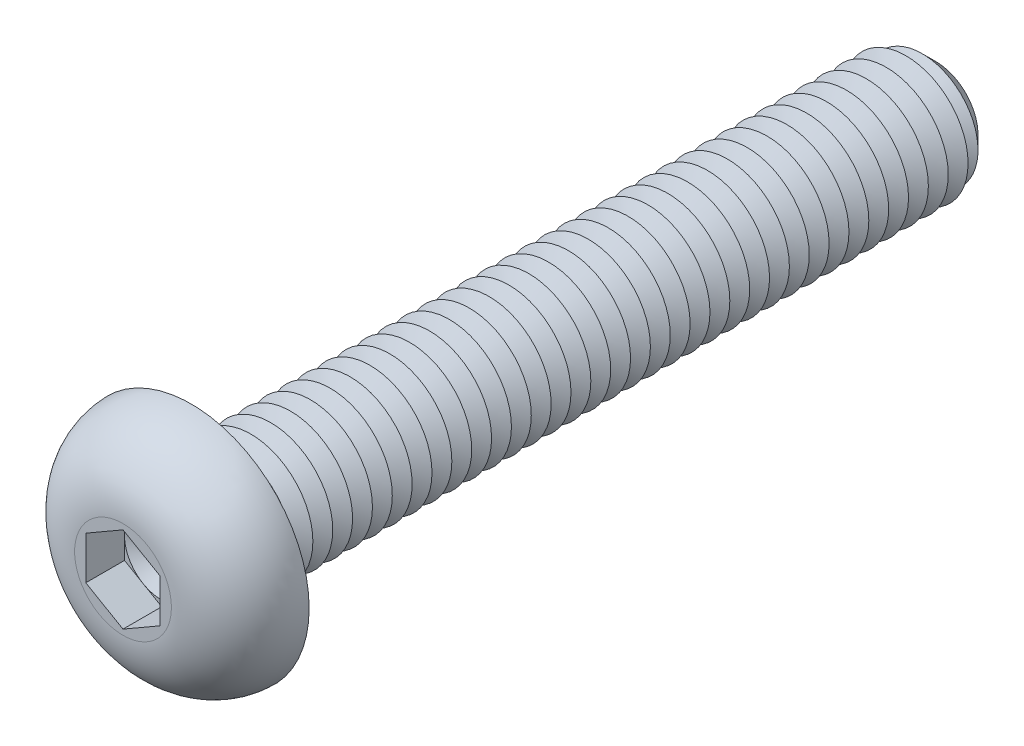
SolidWorks part; units mm, degrees
ref_plane "Front Plane" through (0, 0, 0) normal (0, 0, 1) x (1, 0, 0)
ref_plane "Top Plane" through (0, 0, 0) normal (0, 1, 0) x (1, 0, 0)
ref_plane "Right Plane" through (0, 0, 0) normal (1, 0, 0) x (0, 0, -1)
sketch "Sketch1" plane through (0, 0, 0) normal (1, 0, 0) x (0, 0, -1)
  line L0 (-47.9342, 0) -> (60.3146, 0) construction
sketch "Sketch2" plane through (0, 0, 0) normal (1, 0, 0) x (0, 0, -1)
  line L0 (0, 0) -> (-2.75, 0)
  line L1 (-47.9342, 0) -> (60.3146, 0) construction
  line L2 (-2.75, 0) -> (-2.75, 1.9504)
  line L3 (0, 4.75) -> (0, 0)
  arc A0 (-2.75, 1.9504) -> (0, 4.75) centre (0.05, 1.9504) cw
  dimension "D1" = 2.8
  dimension "D2" = 2.75
  dimension "D3" = 4.75
revolve "Revolve1" add sketch "Sketch2" angle 360 about L0
sketch "Sketch3" plane through (0, 0, 2.75) normal (0, 0, 1) x (1, 0, 0)
  line L1 (0, 1.7321) -> (-1.5, 0.866)
  line L2 (-1.5, 0.866) -> (-1.5, -0.866)
  line L3 (-1.5, -0.866) -> (0, -1.7321)
  line L4 (0, -1.7321) -> (1.5, -0.866)
  line L5 (1.5, -0.866) -> (1.5, 0.866)
  line L6 (1.5, 0.866) -> (0, 1.7321)
  circle A0 centre (0, 0) radius 1.5 construction
  dimension "D1" = 3
extrude "Cut-Extrude1" cut sketch "Sketch3" against normal blind 1.56
sketch "Sketch4" plane through (0, 0, 0) normal (0, 0, -1) x (-1, 0, 0)
  circle A0 centre (0, 0) radius 2.5
  dimension "D1" = 5
extrude "Boss-Extrude1" add sketch "Sketch4" along normal blind 30
chamfer "Chamfer1" distance 0.8 angle 45 1 edges at (-2.5, 0, -30)
sketch "Sketch5" plane through (0, 0, 0) normal (1, 0, 0) x (0, 0, -1)
  line L0 (0.8, 2.5) -> (1.6, 2.5)
  line L1 (29.2, 2.5) -> (0, 2.5) construction
  line L2 (1.6, 2.5) -> (1.2, 1.8072)
  line L3 (1.2, 1.8072) -> (0.8, 2.5)
  line L4 (0, -4.75) -> (0, 4.75) construction
  line L5 (29.2, 2.5) -> (0, 2.5) construction
  dimension "D1" = 0.8
  dimension "D2" = 0.8
revolve "Cut-Revolve1" cut sketch "Sketch5" angle 360 about L0
pattern_linear "LPattern1" count 36 spacing 0.8 along (0, 0, -1) of "Cut-Revolve1"
fillet "Fillet2" radius 0.4 1 edges at (2.5, 0, 0)
sketch "Sketch6" plane through (0, 0, 1.19) normal (0, 0, 1) x (1, 0, 0)
  line L0 (0, -1.7321) -> (1.5, -0.866) construction
  circle A0 centre (0, 0) radius 1.5
extrude "Cut-Extrude2" cut sketch "Sketch6" against normal through all draft 60
